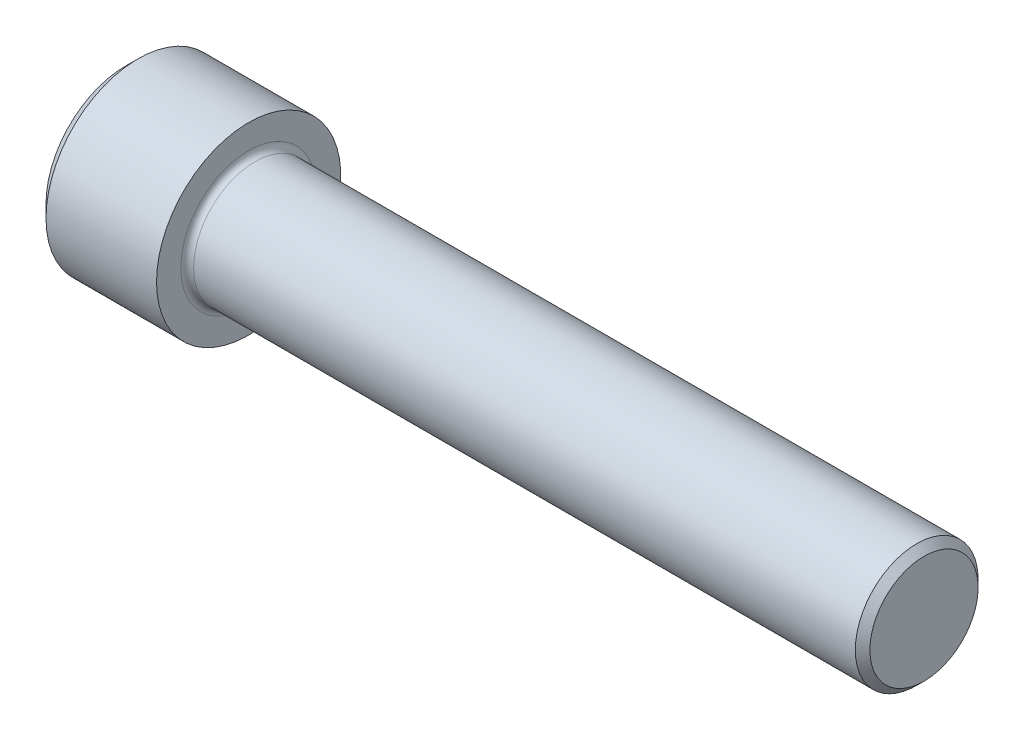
SolidWorks part; units mm, degrees
ref_plane "Plane1" through (0, 0, 0) normal (0, 0, 1) x (1, 0, 0)
ref_plane "Plane2" through (0, 0, 0) normal (0, 1, 0) x (1, 0, 0)
ref_plane "Plane3" through (0, 0, 0) normal (1, 0, 0) x (0, 0, -1)
revolve "Base-Revolve" add sketch "BodySke"
sketch "BodySke" plane through (0, 0, 0) normal (0, 0, 1) x (1, 0, 0)
  line L0 (0, 0) -> (0, 8.255)
  line L1 (1.27, 9.525) -> (12.7, 9.525)
  line L2 (12.7, 9.525) -> (12.7, 6.35)
  line L3 (12.7, 6.35) -> (81.7943, 6.35)
  line L4 (82.55, 5.5943) -> (82.55, 0)
  line L5 (82.55, 0) -> (0, 0)
  line L6 (-31.75, 0) -> (127, 0) construction
  line L7 (0, 8.255) -> (1.27, 9.525)
  line L8 (82.55, 5.5943) -> (81.7943, 6.35)
  line L9 (0, -8.255) -> (1.27, -9.525) construction
  line L10 (82.55, -5.5943) -> (81.7943, -6.35) construction
  line L11 (13.97, 9.525) -> (13.97, 3.175) construction
  line L12 (31.75, 9.525) -> (31.75, 3.175) construction
  line L13 (44.45, 9.525) -> (44.45, 3.175) construction
  dimension "Diameter" = 12.7
  dimension "Head_ht" = 12.7
  dimension "Length" = 69.85
  dimension "Body_ch_ang" = 45
  dimension "Head_dia" = 19.05
  dimension "Head_ch_ang" = 45
  dimension "Head_side_ht" = 11.43
  dimension "Minor_dia" = 11.1887
  dimension "Advance" = 1.27
  dimension "Thread_nom" = 50.8
  dimension "Thread_length" = 38.1
fillet "Fillet1" radius 0.6604 1 edges at (12.7, 0, 6.35)
sketch "Sketch2" plane through (0, 0, 0) normal (0, 0, 1) x (1, 0, 0)
  line L0 (0, 4.7625) -> (6.223, 4.7625)
  line L1 (6.223, 4.7625) -> (8.9726, 0)
  line L2 (-31.75, 0) -> (127, 0) construction
  line L3 (8.9726, 0) -> (0, 0)
  line L4 (0, 0) -> (0, 4.7625)
  line L5 (0, 8.255) -> (0, -8.255) construction
  line L6 (0, 0) -> (47.625, 0) construction
  line L7 (12.7, -9.525) -> (12.7, 9.525) construction
  dimension "D1" = 4.7625
  dimension "D2" = 60
  dimension "Wall_thickness" = 6.477
revolve "Hex-PreBroach" cut sketch "Sketch2" angle 360 about L6
sketch "Sketch3" plane through (0, 0, 0) normal (-1, 0, 0) x (0, 0.5, 0.866)
  line L0 (2.7496, 4.7625) -> (-2.7496, 4.7625)
  line L1 (-2.7496, 4.7625) -> (-5.4993, 0)
  line L2 (2.7496, 4.7625) -> (5.4993, 0)
  line L3 (2.7496, -4.7625) -> (5.4993, 0)
  line L4 (2.7496, -4.7625) -> (-2.7496, -4.7625)
  line L5 (-2.7496, -4.7625) -> (-5.4993, 0)
  dimension "D1" = 4.7625
  dimension "D2" = 4.7625
  dimension "Hex_size" = 9.525
extrude "Hex" cut sketch "Sketch3" against normal blind 6.223
sketch "Sketch4" plane through (0, 0, 0) normal (-1, 0, 0) x (0, 0, 1)
  line L0 (0, 0) -> (5.8801, 0)
  line L1 (0, 0) -> (6.1484, 3.5498) construction
  line L2 (0, 0) -> (2.94, 5.0923)
  line L3 (4.774, 1.1138) -> (5.6523, 1.6209)
  line L4 (3.3516, 3.5775) -> (4.2299, 4.0846)
  arc A0 (4.774, 1.1138) -> (3.3516, 3.5775) centre (0, 0) ccw
  arc A1 (5.8801, 0) -> (5.6523, 1.6209) centre (0, 0) ccw
  arc A2 (2.94, 5.0923) -> (4.2299, 4.0846) centre (0, 0) cw
  dimension "D1" = 30
  dimension "Spline_n_dim" = 9.8044
  dimension "Spline_m_dim" = 11.7602
  dimension "D2" = 60
  dimension "D3" = 1.4224
  dimension "Spline_p_dim" = 2.8448
extrude "Spline" cut sketch "Sketch4" against normal blind 6.223
pattern_circular "CirPattern1" count 6 every 60
sketch "Sketch5" plane through (0, 0, 0) normal (0, 0, 1) x (1, 0, 0)
  line L0 (-31.75, 0) -> (127, 0) construction
  line L2 (0, 8.255) -> (0, -8.255) construction
  circle A0 centre (4.064, 0) radius 0.8065
  dimension "Drilled_hole_dia" = 1.6129
  dimension "Drilled_hole_loc" = 4.064
extrude "Hole" cut sketch "Sketch5" against normal through all and the other way through all
pattern_circular "Drilled-4" count 2 every 60
pattern_circular "Drilled-6" count 3 every 60
sketch "ThdSchSke" plane through (0, 0, 0) normal (0, 0, 1) x (1, 0, 0)
  line L0 (31.75, -5.5943) -> (31.2209, -6.35)
  line L1 (31.75, -5.5943) -> (32.2791, -6.35)
  line L2 (32.2791, -6.35) -> (32.2791, -7.9375)
  line L3 (-3.175, 0) -> (5.1513, 0) construction
  line L5 (32.2791, -7.9375) -> (31.2209, -7.9375)
  line L6 (31.2209, -7.9375) -> (31.2209, -6.35)
  line L7 (0, 8.255) -> (0, -8.255) construction
  dimension "Thread_minor" = 11.1887
  dimension "Diameter" = 12.7
  dimension "Start" = 31.75
  dimension "SideAngle" = 55
  dimension "VeeAngle" = 70
  dimension "Overcut" = 15.875
revolve "ThreadSchematic" cut sketch "ThdSchSke" angle 360 about L3
pattern_linear "ThdSchPat"
equation "\"D2@Sketch3\" = \"Hex_size@Sketch3\" / 2"
equation "\"D1@Sketch3\" = \"Hex_size@Sketch3\" / 2"
equation "\"D1@Sketch2\" = \"Hex_size@Sketch3\" / 2"
equation "\"D3@Sketch4\" = \"Spline_p_dim@Sketch4\" / 2"
equation "\"Thread_minor@ThreadCosmetic\"  =  \"Minor_dia@BodySke\""
equation "\"D2@CirPattern1\" = 360 / \"Num_teeth@CirPattern1\""
equation "\"Wall_thickness@Sketch2\" = \"Head_ht@BodySke\" - \"Key_eng@Hex\""
equation "\"Thread_length@ThreadCosmetic\" = ((sgn( (\"Length@BodySke\" - \"Advance@BodySke\" ) - \"Thread_nom@BodySke\" )-1)*( (\"Length@BodySke\" - \"Advance@BodySke\" ) - \"Thread_nom@BodySke\" ))/-2+ \"Thread_nom@BodySke\""
equation "\"Thread_minor@ThdSchSke\" = \"Minor_dia@BodySke\""
equation "\"Diameter@ThdSchSke\" = \"Diameter@BodySke\""
equation "\"Overcut@ThdSchSke\" = \"Diameter@BodySke\" * 1.25"
equation "\"Start@ThdSchSke\" = \"Head_ht@BodySke\" + \"Length@BodySke\" - \"Thread_length@ThreadCosmetic\"  '---Non-countersunk---"
equation "\"Num_threads@ThdSchPat\" = int( \"Thread_length@ThreadCosmetic\" / \"Advance@BodySke\" + 0.999 )  + 1"
equation "\"Advance@ThdSchPat\" = \"Thread_length@ThreadCosmetic\" /  (\"Num_threads@ThdSchPat\" - 1) 'relax it"
equation "\"Num_threads@ThdSchPat\" = \"Num_threads@ThdSchPat\" - sgn( \"Num_threads@ThdSchPat\" - 1) '---chamfered tips only---"
